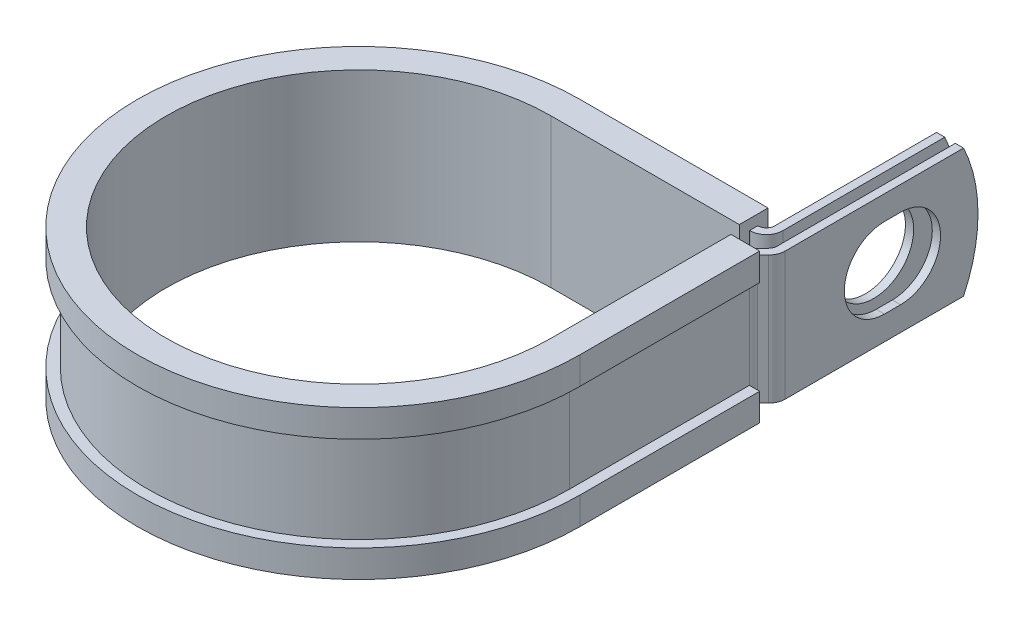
SolidWorks part; units mm, degrees
ref_plane "Front Plane" through (0, 0, 0) normal (0, 0, 1) x (1, 0, 0)
ref_plane "Top Plane" through (0, 0, 0) normal (0, 1, 0) x (1, 0, 0)
ref_plane "Right Plane" through (0, 0, 0) normal (1, 0, 0) x (0, 0, -1)
sketch "Sketch1" plane through (0, 0, 0) normal (0, 1, 0) x (1, 0, 0)
  line L0 (0, 30.099) -> (27.9833, 30.099)
  line L1 (30.099, 0) -> (30.099, 26.6865)
  line L2 (30.4217, 58.7248) -> (30.4217, 32.5374)
  line L3 (30.8132, 28.4107) -> (31.6394, 29.2369)
  line L5 (31.9965, 30.099) -> (31.9965, 58.7248)
  arc A0 (0, 30.099) -> (30.099, 0) centre (0, 0) ccw
  arc A1 (30.8132, 28.4107) -> (30.099, 26.6865) centre (32.5374, 26.6865) ccw
  arc A2 (31.6394, 29.2369) -> (31.9965, 30.099) centre (30.7773, 30.099) ccw
  arc A3 (27.9833, 30.099) -> (30.4217, 32.5374) centre (27.9833, 32.5374) ccw
extrude "Extrude-Thin1" add sketch "Sketch1" along normal mid plane 19.05 thin
sketch "Sketch2" plane through (29.2025, 0, 0) normal (-1, 0, 0) x (0, 0, 1)
  line L0 (-58.7248, 9.525) -> (-58.7248, -9.525) construction
  line L1 (0, 9.525) -> (0, -9.525) construction
  circle A0 centre (-46.0248, 0) radius 5.9436
  point P2 (-58.7248, 0)
extrude "Cut-Extrude1" cut sketch "Sketch2" against normal up to surface (1.2192 mm away)
sketch "Sketch3" plane through (33.2157, 0, 0) normal (1, 0, 0) x (0, 0, -1)
  line L0 (44.831, 0) -> (47.2186, 0) construction
  line L1 (44.831, 5.9436) -> (47.2186, 5.9436)
  line L2 (44.831, -5.9436) -> (47.2186, -5.9436)
  line L3 (58.7248, 9.525) -> (58.7248, -9.525) construction
  arc A0 (44.831, 5.9436) -> (44.831, -5.9436) centre (44.831, 0) ccw
  arc A1 (47.2186, -5.9436) -> (47.2186, 5.9436) centre (47.2186, 0) ccw
  point P3 (46.0248, 0)
  point P8 (58.7248, 0)
  point P11 (38.8874, 0)
  point P12 (53.1622, 0)
extrude "Cut-Extrude2" cut sketch "Sketch3" against normal up to surface (1.2192 mm away)
sketch "Sketch4" plane through (29.2025, 0, 0) normal (-1, 0, 0) x (0, 0, 1)
  line L0 (-58.7248, 9.525) -> (-58.7248, -9.525)
  line L1 (-58.7248, 9.525) -> (-56.5803, 9.525)
  line L2 (-58.7248, 9.525) -> (-32.5374, 9.525) construction
  line L3 (-58.7248, -9.525) -> (-56.5803, -9.525)
  line L4 (-58.7248, -9.525) -> (-32.5374, -9.525) construction
  arc A0 (-56.5803, 9.525) -> (-56.5803, -9.525) centre (-36.4998, 0) ccw
extrude "Cut-Extrude3" cut sketch "Sketch4" against normal through all contours A0 M4 M5 | A0 L0 M2
ref_plane "Plane1" through (0, 0, -26.6865) normal (0, 0, -1) x (-1, 0, 0)
ref_plane "Plane2" through (27.9325, 0, 0) normal (-1, 0, 0) x (0, 0, 1)
sketch "Sketch5" plane through (0, 0, -26.6865) normal (0, 0, -1) x (-1, 0, 0)
  line L0 (-31.3182, 9.525) -> (-30.099, 9.525)
  line L1 (-31.3182, 9.525) -> (-31.3182, -9.525) construction
  line L3 (-30.099, 9.525) -> (-30.099, -9.525)
  line L4 (-30.099, -9.525) -> (-31.3182, -9.525)
  line L5 (-31.3182, -9.525) -> (-31.3182, -6.985)
  line L6 (-31.3182, 9.525) -> (-31.3182, 6.985)
  line L7 (-32.8422, 11.049) -> (-32.8422, 6.985)
  line L8 (-32.8422, 11.049) -> (-28.575, 11.049)
  line L9 (-28.575, 11.049) -> (-28.575, -11.049)
  line L10 (-28.575, -11.049) -> (-32.8422, -11.049)
  line L11 (-32.8422, -11.049) -> (-32.8422, -6.985)
  line L12 (-32.8422, 6.985) -> (-31.3182, 6.985)
  line L13 (-31.3182, -6.985) -> (-32.8422, -6.985)
sketch "Sketch6" plane through (0, 9.525, 0) normal (0, 1, 0) x (1, 0, 0)
  line L0 (28.575, 0) -> (28.575, 26.6865)
  line L1 (28.575, 26.6865) -> (32.8422, 26.6865) construction
  line L2 (27.9325, 6.9878) -> (27.9325, -6.9878) construction
  line L5 (0, 28.575) -> (27.9325, 28.575)
  arc A0 (0, 28.575) -> (28.575, 0) centre (0, 0) ccw
sweep "Sweep1" add profiles "Sketch5" path "Sketch6"
equation "\"D4@Sketch5\" = \"D1@Extrude-Thin1\""
equation "\"D5@Sketch5\" = \"D5@Extrude-Thin1\""
equation "\"D1@Sketch3\" = \"D2@Sketch2\""
equation "\"D7@Sketch1\" = \"D3@Sketch2\" + \"D1@Sketch3\""
equation "\"D1@Sketch1\" = \"D1@Sketch6\" + 2 * \"D3@Sketch5\""
equation "\"D1@Sketch4\" = ( \"D1@Extrude-Thin1\" + .125 ) * 2"
equation "\"D9@Sketch1\"= \"D5@Extrude-Thin1\""
equation "\"D8@Sketch1\"= 2 * \"D5@Extrude-Thin1\""
equation "\"D2@Sketch1\" = 2 * \"D5@Extrude-Thin1\""
equation "\"D2@Sketch3\" = \"D1@Sketch2\""
